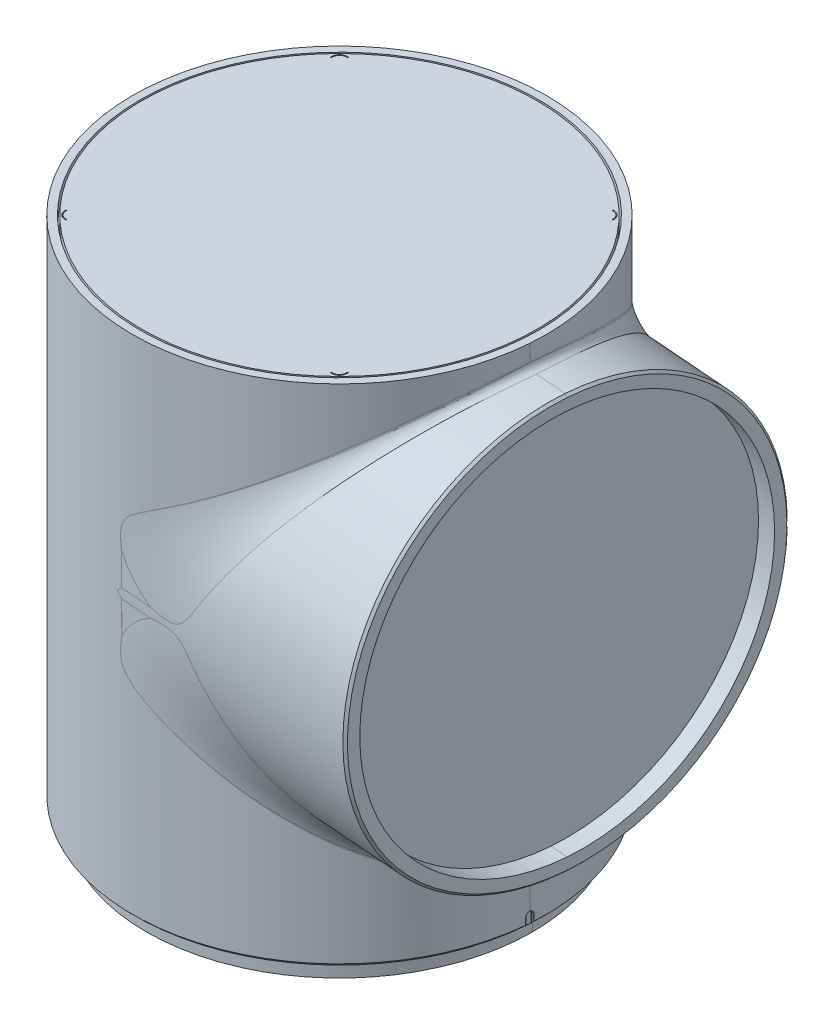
SolidWorks part; units mm, degrees
ref_plane "前视基准面" through (0, 0, 0) normal (0, 0, 1) x (1, 0, 0)
ref_plane "上视基准面" through (0, 0, 0) normal (0, 1, 0) x (1, 0, 0)
ref_plane "右视基准面" through (0, 0, 0) normal (1, 0, 0) x (0, 0, -1)
imported_body "17关节.STEP"
sketch "草图2" plane through (0, 0, 0) normal (0, 0, 1) x (1, 0, 0)
  line L0 (44.3691, 78.2) -> (-44.5, 78.2) construction
  line L1 (-59.225, 116.5925) -> (67.6302, 116.5925)
  line L2 (-59.225, 116.5925) -> (-59.225, 78.2)
  line L3 (-59.225, 78.2) -> (67.6302, 78.2)
  line L4 (67.6302, 116.5925) -> (67.6302, 78.2)
extrude "切除-拉伸1" cut sketch "草图2" against normal mid plane 174
ref_plane "基准面2" through (0, 0, 0) normal (0.0766, 0, -0.9971) x (-0.9971, 0, -0.0766)
sketch "草图3" plane through (0, 78.2, 0) normal (0, 1, 0) x (1, 0, 0)
  circle A0 centre (0, 0) radius 82.0181
extrude "切除-拉伸2" cut sketch "草图3" against normal blind 2
sketch "草图4" plane through (49.8529, 0, 3.8321) normal (0.9971, 0, 0.0766) x (0.0766, 0, -0.9971)
  circle A0 centre (-0.3013, 26.2183) radius 42.3019
extrude "凸台-拉伸2" add sketch "草图4" against normal blind 3
